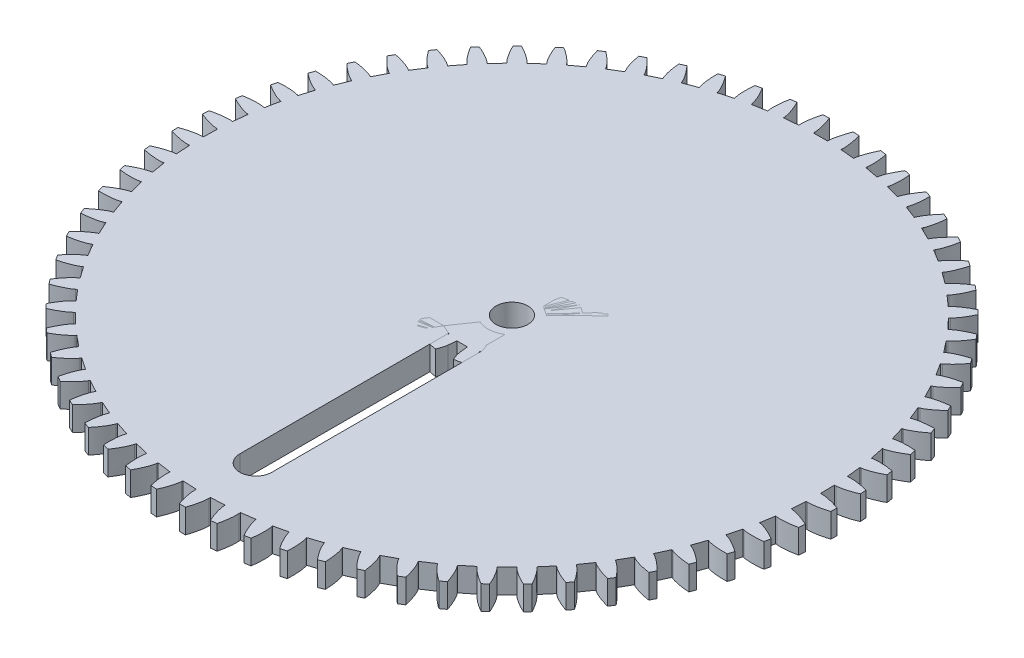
SolidWorks part; units mm, degrees
ref_plane "Front Plane" through (0, 0, 0) normal (0, 0, 1) x (1, 0, 0)
ref_plane "Top Plane" through (0, 0, 0) normal (0, 1, 0) x (1, 0, 0)
ref_plane "Right Plane" through (0, 0, 0) normal (1, 0, 0) x (0, 0, -1)
sketch "Sketch1" plane through (0, 0, 0) normal (0, 1, 0) x (1, 0, 0)
  line L0 (0, 0) -> (0, 19.3726) construction
  line L1 (0, 0) -> (-19.3726, 0) construction
  line L2 (0, 0) -> (-20.5847, -0.4687) construction
  line L3 (0, 0) -> (-19.3526, -0.8817) construction
  line L4 (0, 0) -> (-19.2924, -1.7616) construction
  circle A0 centre (0, 0) radius 20.01 construction
  circle A1 centre (0, 0) radius 19.3726 construction
  circle A2 centre (0, 0) radius 19.285 construction
  circle A3 centre (0, 0) radius 20.59 construction
  spline S0 degree 4 poles (-19.3726, 0) (-19.4031, 0) (-19.4885, -0.0031) (-19.6494, -0.0214) (-19.9094, -0.0687) (-20.2357, -0.1543) (-20.6496, -0.2935) (-21.1251, -0.4935) (-21.6322, -0.7502) (-22.1648, -1.0676) (-22.6774, -1.4175) (-23.1695, -1.7955) (-23.6412, -2.1985) (-24.1893, -2.7148) (-24.8127, -3.3752) (-25.4883, -4.197) (-26.1888, -5.1944) (-26.8271, -6.2594) (-27.392, -7.3643) (-27.8237, -8.3616) (-28.1499, -9.232) (-28.3934, -9.9701) (-28.5711, -10.561) (-28.7726, -11.3165) (-28.9461, -12.0601) (-29.0938, -12.84) (-29.2376, -13.7311) (-29.3339, -14.5513) (-29.4001, -15.2379) (-29.4468, -16.1062) (-29.4623, -16.5496) (-29.4725, -17.1758) (-29.468, -17.6402) (-29.4597, -18.0624) (-29.4494, -18.2985) (-29.4441, -18.4363) knots 0 0 0 0 0 0.005377 0.015084 0.028532 0.04661 0.064855 0.092111 0.119476 0.146842 0.174209 0.201575 0.228941 0.256307 0.307035 0.361767 0.4165 0.471232 0.525964 0.580697 0.608063 0.635429 0.662795 0.690161 0.744894 0.77226 0.799626 0.854358 0.881725 0.909091 0.931818 0.954545 0.977273 1 1 1 1 1 construction
  spline S1 degree 4 poles (-19.3726, 0) (-19.4031, 0) (-19.4885, -0.0031) (-19.6494, -0.0214) (-19.9094, -0.0687) (-20.2357, -0.1543) (-20.6496, -0.2935) (-21.1251, -0.4935) (-21.6322, -0.7502) (-22.1648, -1.0676) (-22.6774, -1.4175) (-23.1695, -1.7955) (-23.6412, -2.1985) (-24.1893, -2.7148) (-24.8127, -3.3752) (-25.4883, -4.197) (-26.1888, -5.1944) (-26.8271, -6.2594) (-27.392, -7.3643) (-27.8237, -8.3616) (-28.1499, -9.232) (-28.3934, -9.9701) (-28.5711, -10.561) (-28.7726, -11.3165) (-28.9461, -12.0601) (-29.0938, -12.84) (-29.2376, -13.7311) (-29.3339, -14.5513) (-29.4001, -15.2379) (-29.4388, -15.9569) (-29.4504, -16.2336) (-29.4551, -16.3744) knots 0 0 0 0 0 0.005377 0.015084 0.028532 0.04661 0.064855 0.092111 0.119476 0.146842 0.174209 0.201575 0.228941 0.256307 0.307035 0.361767 0.4165 0.471232 0.525964 0.580697 0.608063 0.635429 0.662795 0.690161 0.744894 0.77226 0.799626 0.854358 0.881725 0.909091 0.909091 0.909091 0.909091 0.909091
  dimension "D1" = 41.18
  dimension "D2" = 40.02
  dimension "D3" = 38.7453
  dimension "D4" = 38.57
  dimension "D5" = 19.3726
  dimension "D6" = 1.304
  dimension "D7" = 2.609
  dimension "D8" = 5.217
sketch "Sketch2" plane through (0, 0, 0) normal (0, 1, 0) x (1, 0, 0)
  line L0 (0, 0) -> (-20.5847, -0.4687) construction
  line L1 (0, 0) -> (-20.5847, -0.4687) construction
  line L2 (0, 0) -> (-19.3526, -0.8817) construction
  line L3 (0, 0) -> (-19.3726, 0) construction
  line L4 (0, 0) -> (-19.2924, -1.7616) construction
  line L5 (0, 0) -> (-19.3526, -0.8817) construction
  line L6 (0, 0) -> (-19.3726, 0) construction
  line L7 (0, 0) -> (-19.2924, -1.7616) construction
  line L8 (-19.3526, -0.8817) -> (-19.265, -0.8777)
  line L9 (-19.265, -0.8777) -> (-19.2051, -1.7537)
  line L10 (-19.2051, -1.7537) -> (-19.2924, -1.7616) construction
  line L11 (-19.2051, -1.7537) -> (-0.9959, -0.0909)
  line L12 (-19.3726, 0) -> (-1, 0)
  circle A0 centre (0, 0) radius 19.285 construction
  circle A1 centre (0, 0) radius 19.3726 construction
  circle A2 centre (0, 0) radius 20.01 construction
  circle A3 centre (0, 0) radius 20.59 construction
  circle A4 centre (0, 0) radius 19.285 construction
  circle A5 centre (0, 0) radius 19.3726 construction
  circle A6 centre (0, 0) radius 20.01 construction
  circle A7 centre (0, 0) radius 20.59 construction
  arc A8 (-20.5794, -0.6592) -> (-20.5881, -0.2782) centre (0, 0) cw
  circle A11 centre (0, 0) radius 1 construction
  arc A12 (-1, 0) -> (-0.9959, -0.0909) centre (0, 0) ccw
  spline S0 degree 4 poles (-77.8065, -1999.0189) (-14.522, -44.9614) (-15.5835, -0.9788) (-17.8293, 0.3096) (-19.9094, -0.0687) (-20.2357, -0.1543) (-20.6496, -0.2935) (-21.1251, -0.4935) (-21.6322, -0.7502) (-22.1648, -1.0676) (-22.6774, -1.4175) (-23.1695, -1.7955) (-23.6412, -2.1985) (-24.1893, -2.7148) (-24.8127, -3.3752) (-25.4883, -4.197) (-26.1888, -5.1944) (-26.8271, -6.2594) (-27.392, -7.3643) (-27.8237, -8.3616) (-28.1499, -9.232) (-28.3934, -9.9701) (-28.5711, -10.561) (-28.7726, -11.3165) (-28.9461, -12.0601) (-29.0938, -12.84) (-29.2376, -13.7311) (-29.3339, -14.5513) (-29.5919, -17.2245) (-29.5306, -23.3787) (-26.9478, 38.1967) (-94.5081, -2015.1776) knots -0.326324 -0.326324 -0.326324 -0.326324 -0.326324 0.005377 0.015084 0.028532 0.04661 0.064855 0.092111 0.119476 0.146842 0.174209 0.201575 0.228941 0.256307 0.307035 0.361767 0.4165 0.471232 0.525964 0.580697 0.608063 0.635429 0.662795 0.690161 0.744894 0.77226 0.799626 0.854358 0.881725 1.305006 1.305006 1.305006 1.305006 1.305006 only from (-19.3726, 0) to (-29.4551, -16.3744) construction
  spline S1 degree 4 poles (-19.3726, 0) (-19.4031, 0) (-19.4885, -0.0031) (-19.6494, -0.0214) (-19.9094, -0.0687) (-20.183, -0.1405) (-20.3997, -0.2102) (-20.5422, -0.2612) (-20.5881, -0.2782) knots 0 0 0 0 0 0.005377 0.015084 0.028532 0.04661 0.055247 0.055247 0.055247 0.055247 0.055247
  spline S2 degree 4 poles (-19.3526, -0.8817) (-19.383, -0.8831) (-19.4685, -0.8839) (-19.63, -0.8729) (-19.8919, -0.8375) (-20.1685, -0.7783) (-20.3881, -0.7185) (-20.5328, -0.674) (-20.5794, -0.6592) knots 0 0 0 0 0 0.005377 0.015084 0.028532 0.04661 0.055247 0.055247 0.055247 0.055247 0.055247
  point P21 (-19.265, -0.8777)
  point P24 (-19.2051, -1.7537)
  dimension "D2" = 2
extrude "Boss-Extrude1" add sketch "Sketch2" along normal blind 1.5
pattern_circular "CirPattern1" count 69 over 360 of "Boss-Extrude1"
sketch "Sketch3" plane through (0, 1.5, 0) normal (0, 1, 0) x (1, 0, 0)
  line L0 (0, -3) -> (0, -16) construction
  line L1 (1, -3) -> (1, -16)
  line L2 (-1, -3) -> (-1, -16)
  arc A0 (1, -3) -> (-1, -3) centre (0, -3) ccw
  arc A1 (-1, -16) -> (1, -16) centre (0, -16) ccw
  point P3 (0, -9.5)
  dimension "D1" = 1
  dimension "D2" = 13
  dimension "D3" = 3
extrude "Cut-Extrude1" cut sketch "Sketch3" against normal up to surface (1.5 mm away)
equation "\"Module\"= .58"
equation "\"Number of Teeth\"= 69"
equation "\"Pressure Angle\"= 14.5deg"
equation "\"Pitch Diameter\"= \"Number of Teeth\" * \"Module\""
equation "\"Circular Pitch\"= pi * \"Module\""
equation "\"Addendum\"= \"Module\""
equation "\"Dedendum\"= 1.25 * \"Module\""
equation "\"Base Diameter\"= \"Pitch Diameter\" * cos ( \"Pressure Angle\" )"
equation "\"Base Radius\"= \"Base Diameter\" / 2"
equation "\"Width\"= 1.5"
equation "\"Outside Diameter\"= \"Pitch Diameter\" + 2 * \"Addendum\""
equation "\"D1@Sketch1\"=\"Outside Diameter\""
equation "\"D3@Sketch1\"=\"Base Diameter\""
equation "\"Root Diameter\"= \"Pitch Diameter\" - 2 * \"Dedendum\""
equation "\"D4@Sketch1\"=\"Root Diameter\""
equation "\"Tooth Angle\"= 360 / \"Number of Teeth\""
equation "\"D6@Sketch1\"=\"Tooth Angle\"/4"
equation "\"D7@Sketch1\"=\"Tooth Angle\"/2"
equation "\"D8@Sketch1\"=\"Tooth Angle\""
equation "\"D2@Sketch1\" = \"Pitch Diameter\""
equation "\"Shaft Diameter\"= 2"
equation "\"D1@CirPattern1\" = \"Number of Teeth\""
equation "\"D2@Sketch2\"= \"Shaft Diameter\""
equation "\"D1@Boss-Extrude1\" = \"Width\""
